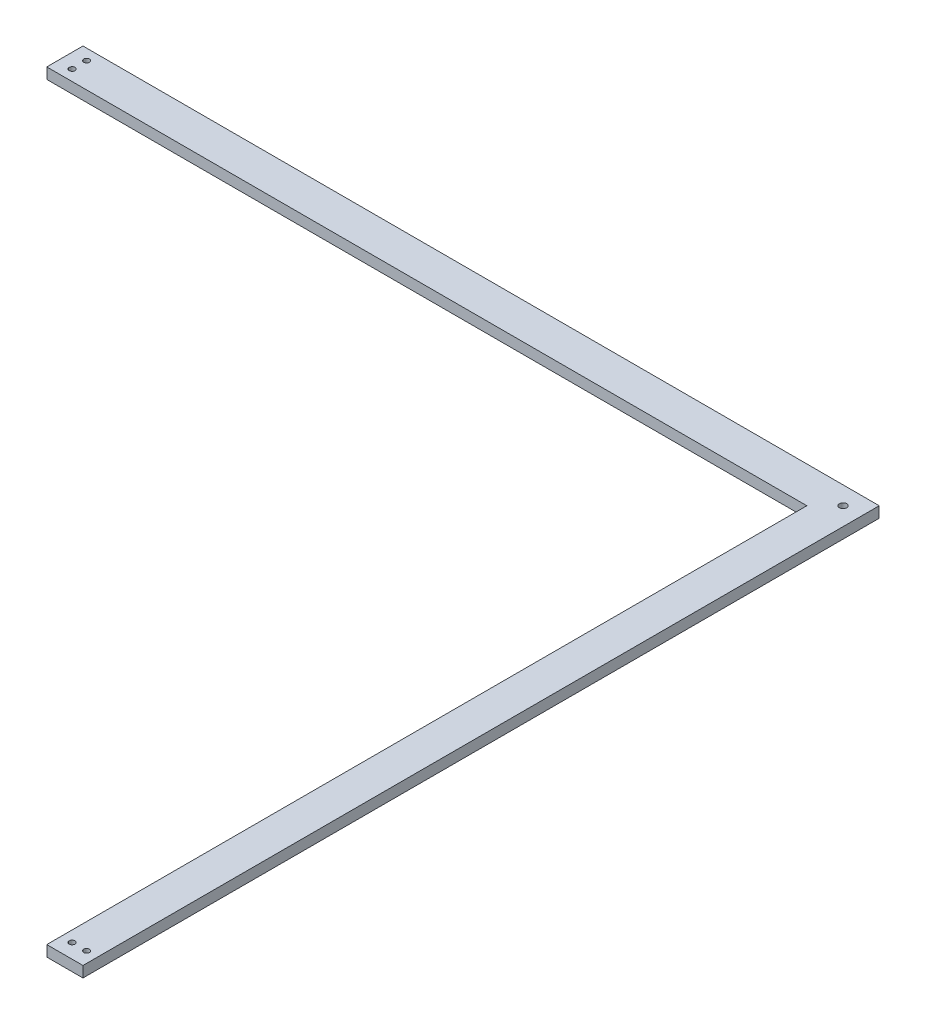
SolidWorks part; units mm, degrees
ref_plane "Front Plane" through (0, 0, 0) normal (0, 0, 1) x (1, 0, 0)
ref_plane "Top Plane" through (0, 0, 0) normal (0, 1, 0) x (1, 0, 0)
ref_plane "Right Plane" through (0, 0, 0) normal (1, 0, 0) x (0, 0, -1)
sketch "Sketch1" plane through (0, 0, 0) normal (0, 1, 0) x (1, 0, 0)
  line L0 (0, 220) -> (0, 210)
  line L1 (210, 0) -> (220, 0)
  line L2 (0, 315.2642) -> (0, -237.1001) construction
  line L3 (-143.3446, 0) -> (513.5023, 0) construction
  line L4 (215, 0) -> (215, 6.9808) construction
  line L5 (0, 215) -> (8.9843, 215) construction
  line L6 (0, 220) -> (253.7557, 220) construction
  line L7 (220, 0) -> (220, 220) construction
  line L9 (0, 220) -> (220, 220)
  line L10 (0, 220) -> (0, 210)
  line L11 (0, 210) -> (210, 210)
  line L12 (220, 220) -> (220, 210)
  line L13 (210, 0) -> (220, 0)
  line L14 (210, 0) -> (210, 210)
  line L15 (210, 220) -> (220, 220)
  line L16 (220, 0) -> (220, 220)
  circle A2 centre (215, 215) radius 1
  circle A4 centre (217, 4) radius 0.8
  circle A5 centre (213, 4) radius 0.8
  circle A6 centre (4, 217) radius 0.8
  circle A7 centre (4, 213) radius 0.8
  dimension "D1" = 10
  dimension "D2" = 10
  dimension "D3" = 1.6
  dimension "D6" = 1.6
  dimension "D9" = 220
  dimension "D12" = 2
  dimension "D4" = 4
  dimension "D5" = 2
  dimension "D7" = 4
  dimension "D8" = 2
  dimension "D10" = 10
  dimension "D11" = 210
  dimension "D13" = 5
  dimension "D14" = 5
extrude "Boss-Extrude1" add sketch "Sketch1" along normal blind 3 contours L1 L16 L12 L9 L0 L11 L14 A5 A4 A6 A7
